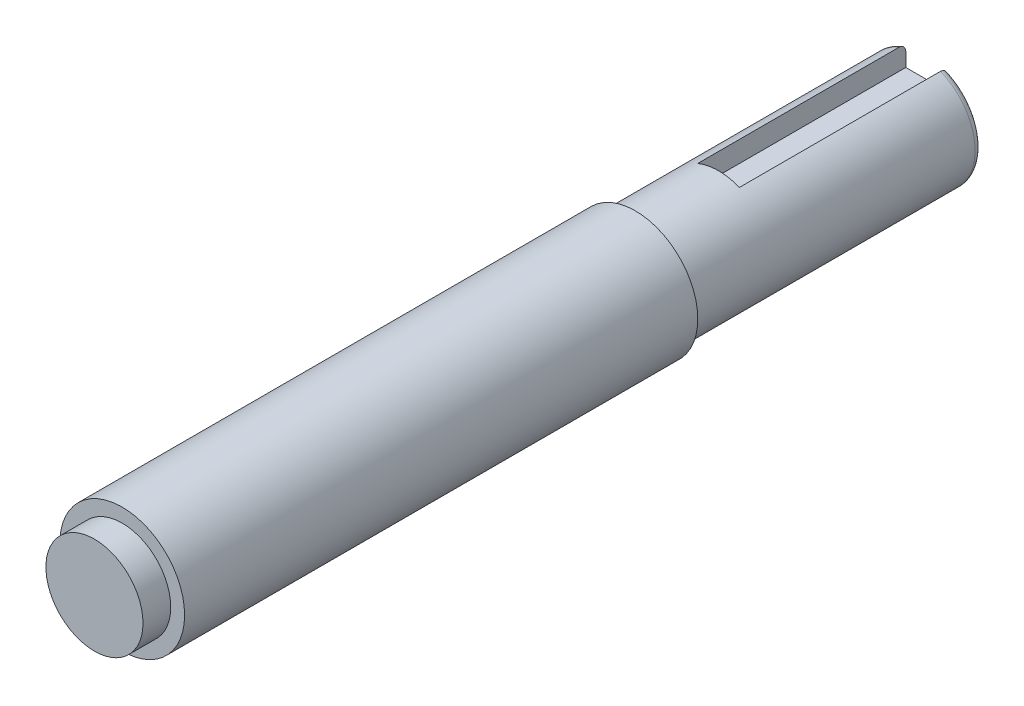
SolidWorks part; units mm, degrees
ref_plane "前视" through (0, 0, 0) normal (0, 0, 1) x (1, 0, 0)
ref_plane "上视" through (0, 0, 0) normal (0, 1, 0) x (1, 0, 0)
ref_plane "右视" through (0, 0, 0) normal (1, 0, 0) x (0, 0, -1)
sketch "草图1" plane through (0, 0, 0) normal (0, 0, 1) x (1, 0, 0)
  circle A0 centre (0, 0) radius 4
extrude "凸台-拉伸1" add sketch "草图1" along normal blind 21
sketch "草图2" plane through (0, 0, 21) normal (0, 0, 1) x (1, 0, 0)
  circle A0 centre (0, 0) radius 4.5
extrude "凸台-拉伸2" add sketch "草图2" along normal blind 37
sketch "草图4" plane through (0, 0, 0) normal (0, 0, -1) x (-1, 0, 0)
  line L0 (-1.5, 2.2) -> (0, 2.2)
  line L3 (0, 2.2) -> (1.5, 2.2)
  line L4 (-1.5, 2.2) -> (-1.5, 3.7081)
  line L5 (1.5, 2.2) -> (1.5, 3.7081)
  arc A0 (1.5, 3.7081) -> (-1.5, 3.7081) centre (0, 0) ccw
extrude "切除-拉伸1" cut sketch "草图4" against normal blind 15
sketch "草图5" plane through (0, 0, 58) normal (0, 0, 1) x (1, 0, 0)
  circle A0 centre (0, 0) radius 3.5
extrude "凸台-拉伸3" add sketch "草图5" along normal blind 2
fillet "圆角1" radius 0.5 1 edges at (0, -4, 0)
